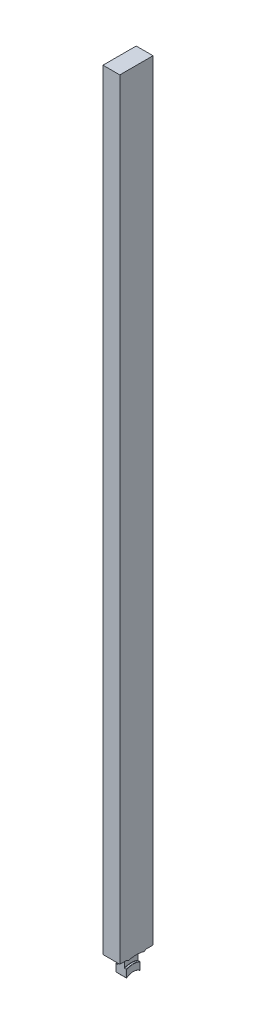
SolidWorks part; units mm, degrees
other "<4-48 DETENT>-<Imported1>"
other "<4-48 DETENT>-<Imported2>"
ref_plane "Front Plane" through (0, 0, 0) normal (0, 0, 1) x (1, 0, 0)
ref_plane "Top Plane" through (0, 0, 0) normal (0, 1, 0) x (1, 0, 0)
ref_plane "Right Plane" through (0, 0, 0) normal (1, 0, 0) x (0, 0, -1)
sketch "Sketch1" plane through (0, 0, 0) normal (1, 0, 0) x (0, 0, -1)
  line L0 (-9.652, 463.55) -> (-9.652, 0)
  line L1 (0, 249.2329) -> (0, 0) construction
  line L2 (9.652, 463.55) -> (9.652, 0)
  line L3 (-9.652, 463.55) -> (9.652, 463.55)
  line L4 (-9.652, 0) -> (9.652, 0)
  circle A1 centre (0, 0) radius 6.35 construction
  point P5 (0, 5.969)
  dimension "D1" = 6.35
  dimension "D2" = 457.2
  dimension "D3" = 19.304
  dimension "D4" = 0.381
extrude "Boss-Extrude1" add sketch "Sketch1" along normal mid plane 9.779
sketch "Sketch2" plane through (0, 0, 0) normal (0, 0, 1) x (1, 0, 0)
  line L0 (4.8895, 10.3124) -> (1.905, 10.3124)
  line L1 (4.8895, 463.55) -> (4.8895, 0) construction
  line L2 (1.905, 10.3124) -> (1.905, 15.875)
  line L3 (1.905, 15.875) -> (4.8895, 15.875)
  line L4 (4.8895, 15.875) -> (4.8895, 10.3124)
  line L5 (0, 29.9173) -> (0, 0) construction
  line L6 (-4.8895, 15.875) -> (-4.8895, 10.3124)
  line L7 (-1.905, 15.875) -> (-4.8895, 15.875)
  line L8 (-1.905, 10.3124) -> (-1.905, 15.875)
  line L9 (-4.8895, 10.3124) -> (-1.905, 10.3124)
  line L10 (-8.8482, 0) -> (24.5305, 0) construction
  dimension "D1" = 3.81
  dimension "D2" = 15.875
  dimension "D3" = 10.3124
revolve "Cut-Revolve1" cut sketch "Sketch2" angle 360 about L10
sketch "Sketch6" plane through (0, 0, 0) normal (1, 0, 0) x (0, 0, -1)
  line L0 (0, 19.903) -> (0, 3.2785) construction
  line L1 (3.9624, 0) -> (19.2024, 0)
  line L2 (3.9624, 0) -> (3.9624, 13.589)
  line L3 (6.2484, 15.875) -> (19.2024, 15.875)
  line L4 (19.2024, 0) -> (19.2024, 15.875)
  line L9 (-3.9624, 0) -> (-19.2024, 0)
  line L10 (-19.2024, 0) -> (-19.2024, 15.875)
  line L11 (-6.2484, 15.875) -> (-19.2024, 15.875)
  line L12 (-3.9624, 0) -> (-3.9624, 13.589)
  line L13 (-9.652, 0) -> (9.652, 0) construction
  line L14 (-9.652, 22.1375) -> (-9.652, 15.875) construction
  line L15 (-9.652, 463.55) -> (-9.652, 12.6038) construction
  arc A0 (3.9624, 13.589) -> (6.2484, 15.875) centre (6.2484, 13.589) cw
  arc A1 (-3.9624, 13.589) -> (-6.2484, 15.875) centre (-6.2484, 13.589) ccw
  dimension "D3" = 2.286
  dimension "D1" = 7.9248
  dimension "D2" = 15.24
  dimension "D4" = 15.875
extrude "Cut-Extrude2" cut sketch "Sketch6" against normal through all both and the other way through all
sketch "Sketch7" plane through (0, 0, 0) normal (1, 0, 0) x (0, 0, -1)
  circle A0 centre (0, 0) radius 6.35
  dimension "D1" = 6.35
extrude "Cut-Extrude3" cut sketch "Sketch7" against normal through all both and the other way through all
sketch "Sketch8" plane through (0, 0, 0) normal (0, 0, 1) x (1, 0, 0)
  line L1 (-4.8895, 10.3124) -> (-3.048, 10.3124)
  line L2 (-4.8895, 10.3124) -> (-4.8895, 4.962)
  line L3 (-4.8895, 4.962) -> (-3.048, 4.962)
  line L4 (-3.048, 10.3124) -> (-3.048, 4.962)
  line L5 (0, 18.3159) -> (0, 0) construction
  line L6 (3.048, 10.3124) -> (3.048, 4.962)
  line L7 (4.8895, 4.962) -> (3.048, 4.962)
  line L8 (4.8895, 10.3124) -> (4.8895, 4.962)
  line L9 (4.8895, 10.3124) -> (3.048, 10.3124)
  line L10 (-4.8895, 4.962) -> (4.8895, 4.962) construction
  dimension "D1" = 6.096
extrude "Cut-Extrude4" cut sketch "Sketch8" against normal through all both and the other way through all
fillet "Fillet1" radius 0.762 2 edges at (-1.905, 15.875, 0) (1.905, 15.875, 0)
fillet "Fillet2" radius 0.127 2 edges at (-1.905, 10.3124, 0) (1.905, 10.3124, 0)
hole_wizard "#4-48 Tapped Hole1" positions "Sketch3" profile "Sketch4" tap size "#4-48" standard "ANSI Inch"
sketch "Sketch3" plane through (0, 0, 0) normal (0, 1, 0) x (1, 0, 0)
  point P0 (0, 0)
sketch "Sketch4" plane through (0, 0, 0) normal (1, 0, 0) x (0, 0, -1)
  line L0 (0, 0) -> (0, 13.9215)
  line L1 (0, 13.9215) -> (1.1874, 13.208)
  line L2 (1.1874, 13.208) -> (1.1874, 0)
  line L5 (1.1874, 0) -> (0, 0)
  line L10 (0, 13.9215) -> (-1.1875, 13.208) construction
  line L11 (0, -6.35) -> (0, 107.95) construction
  dimension "Tap Drill Dia." = 2.3749
  dimension "Tap Drill Depth" = 13.208
  dimension "Drill Angle" = 118
fillet "Fillet3" radius 0.127 10 edges at (0, 4.962, -3.9624) (-3.048, 6.35, 0) (3.048, 6.35, 0) (0, 4.962, 3.9624) (-3.048, 7.2414, 3.9624) (-3.048, 10.3124, 0) (-3.048, 7.2414, -3.9624) (3.048, 7.2414, -3.9624) (3.048, 10.3124, 0) (3.048, 7.2414, 3.9624)
ref_plane "Plane1" through (0, 5.969, 0) normal (0, 1, 0) x (1, 0, 0)
inserted part "4-48 DETENT"
move or copy body "Body-Move/Copy2" placed by mates yes
